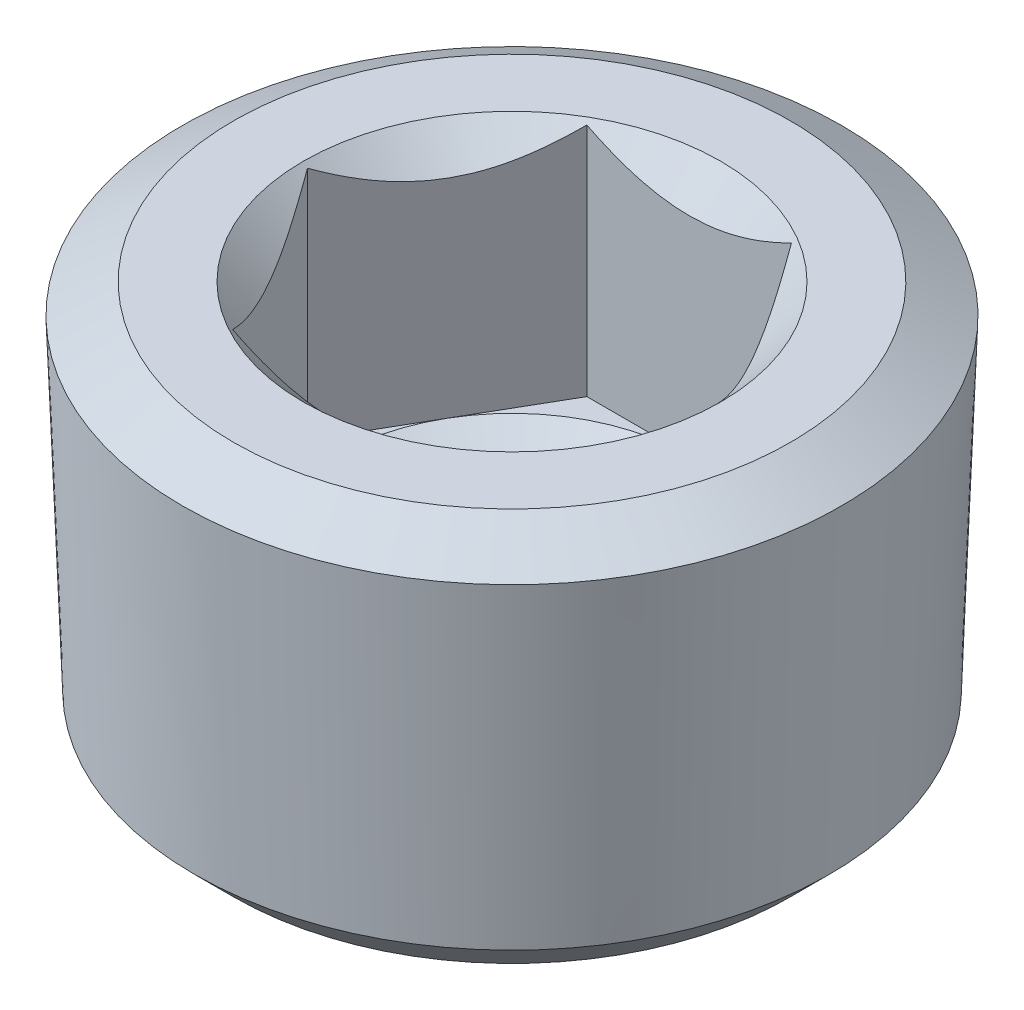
SolidWorks part; units mm, degrees
ref_plane "Front Plane" through (0, 0, 0) normal (0, 0, 1) x (1, 0, 0)
ref_plane "Top Plane" through (0, 0, 0) normal (0, 1, 0) x (1, 0, 0)
ref_plane "Right Plane" through (0, 0, 0) normal (1, 0, 0) x (0, 0, -1)
sketch "Sketch2" plane through (0, 0, 0) normal (0, 0, 1) x (1, 0, 0)
  line L0 (0, 10.7443) -> (0, -17.0657) construction
  line L1 (0, 0) -> (-11.2322, 0)
  line L2 (-13.2917, -1.189) -> (-12.8139, -14.2933)
  line L3 (-11.2322, -15.875) -> (0, -15.875)
  line L4 (0, -15.875) -> (0, 0)
  line L6 (-11.2322, -15.875) -> (-12.8139, -14.2933)
  line L7 (-11.2322, 0) -> (-13.2917, -1.189)
  point P4 (-13.335, 0)
  point P6 (-12.7562, -15.875)
  dimension "D1" = 15.875
  dimension "D2" = 2.088
  dimension "D3" = 26.67
  dimension "D4" = 30
  dimension "D5" = 1.524
  dimension "D6" = 45
revolve "Revolve1" add sketch "Sketch2" angle 360 about L0
sketch "Sketch3" plane through (0, 0, 0) normal (0, 0, 1) x (1, 0, 0)
  line L0 (0, 2.9342) -> (0, -8.1202) construction
  line L1 (0, 0) -> (-8.4137, 0)
  line L2 (11.2322, 0) -> (-11.2322, 0) construction
  line L3 (-7.1437, -1.27) -> (-7.1437, -9.652)
  line L4 (-7.1437, -9.652) -> (-2.9165, -12.192)
  line L5 (0, -12.192) -> (0, 0)
  line L6 (-7.1437, -1.27) -> (-8.4137, 0)
  line L7 (-2.9165, -12.192) -> (0, -12.192)
  dimension "D1" = 9.652
  dimension "D2" = 59
  dimension "D3" = 14.2875
  dimension "D4" = 1.27
  dimension "D5" = 45
  dimension "D6" = 12.192
revolve "Cut-Revolve1" cut sketch "Sketch3" angle 360 about L0
sketch "Sketch4" plane through (0, 0, 0) normal (0, 1, 0) x (1, 0, 0)
  line L1 (-4.1244, -7.1437) -> (4.1244, -7.1437)
  line L2 (4.1244, -7.1437) -> (8.2489, 0)
  line L3 (8.2489, 0) -> (4.1244, 7.1437)
  line L4 (4.1244, 7.1437) -> (-4.1244, 7.1437)
  line L5 (-4.1244, 7.1437) -> (-8.2489, 0)
  line L6 (-8.2489, 0) -> (-4.1244, -7.1437)
  circle A0 centre (0, 0) radius 7.1437 construction
  circle A1 centre (0, 0) radius 7.1437 construction
extrude "Cut-Extrude1" cut sketch "Sketch4" against normal up to vertex (5.2929 mm away)
